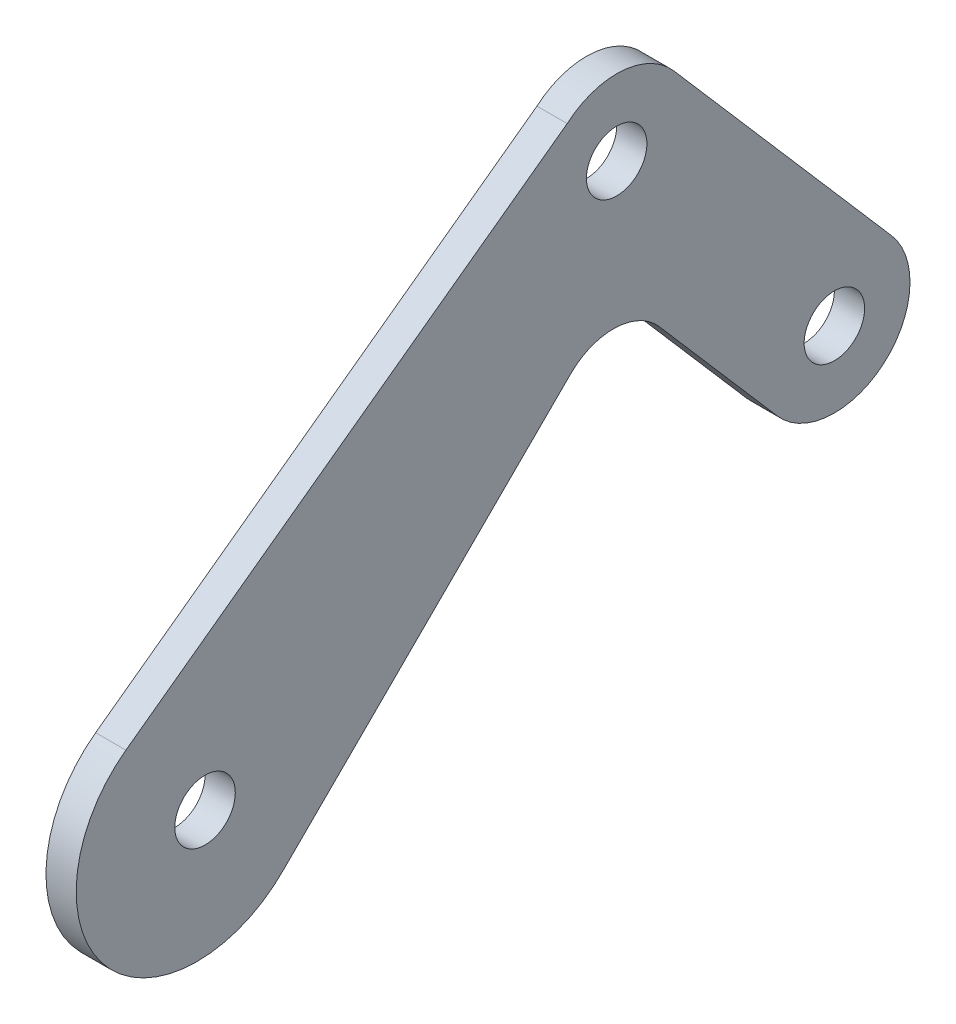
SolidWorks part; units mm, degrees
ref_plane "Front Plane" through (0, 0, 0) normal (0, 0, 1) x (1, 0, 0)
ref_plane "Top Plane" through (0, 0, 0) normal (0, 1, 0) x (1, 0, 0)
ref_plane "Right Plane" through (0, 0, 0) normal (1, 0, 0) x (0, 0, -1)
sketch "Sketch1" plane through (0, 0, 0) normal (1, 0, 0) x (0, 0, -1)
  line L0 (0, 0) -> (-43.2126, -37.4005) construction
  line L1 (0, 0) -> (22.8559, -26.4077) construction
  line L2 (-43.2126, -37.4005) -> (-20.3567, -63.8082) construction
  line L3 (22.8559, -26.4077) -> (-20.3567, -63.8082) construction
  line L4 (16.8541, -31.6022) -> (4.4563, -17.2778)
  line L5 (22.8559, -26.4077) -> (58.3525, 4.3147) construction
  line L6 (28.8576, -21.2132) -> (6.0017, 5.1945)
  line L7 (-43.2126, -37.4005) -> (-76.3416, 0.8768) construction
  line L8 (-34.9587, -46.937) -> (-4.8255, -16.9336)
  line L9 (-5.1945, 6.0017) -> (-51.5238, -27.7977)
  line L10 (-61.3926, -16.3952) -> (-9.8123, 28.2476) construction
  line L11 (0, 0) -> (-18.1801, 21.0053) construction
  line L12 (0, 0) -> (22.5943, 19.5554) construction
  line L13 (-43.2126, -37.4005) -> (-62.0308, -52.3663) construction
  circle A0 centre (0, 0) radius 3.175
  circle A1 centre (22.8559, -26.4077) radius 3.175
  circle A2 centre (-43.2126, -37.4005) radius 3.175
  arc A3 (16.8541, -31.6022) -> (28.8576, -21.2132) centre (22.8559, -26.4077) ccw
  arc A4 (-51.5238, -27.7977) -> (-34.9587, -46.937) centre (-44.0387, -38.0575) ccw
  arc A5 (-5.1945, 6.0017) -> (6.0017, 5.1945) centre (0, 0) cw
  arc A6 (4.4563, -17.2778) -> (-4.8255, -16.9336) centre (-0.345, -21.4334) ccw
  point P26 (0, -12.1289)
  dimension "D3" = 6.35
  dimension "D6" = 12.7
  dimension "D10" = 6.35
  dimension "D8" = 7.9375
  dimension "D9" = 12.7
  dimension "D4" = 7.9375
  dimension "D1" = 34.925
  dimension "D2" = 57.15
  dimension "D5" = 21.4334
  dimension "D7" = 4
  dimension "D11" = 43.7607
extrude "Boss-Extrude1" add sketch "Sketch1" along normal mid plane 3.175
